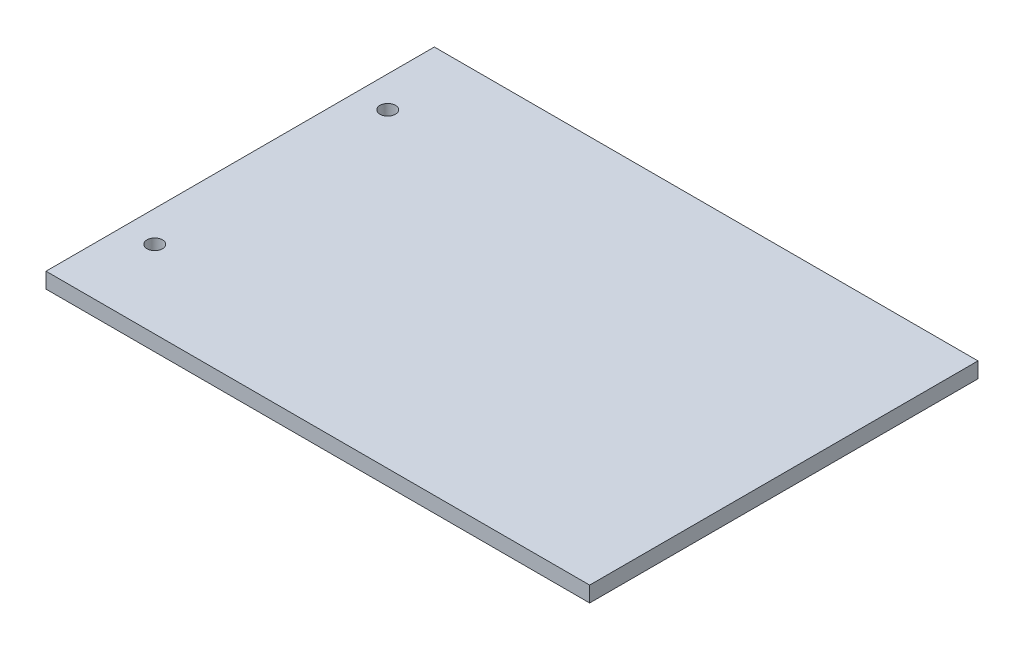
SolidWorks part; units mm, degrees
ref_plane "Front Plane" through (0, 0, 0) normal (0, 0, 1) x (1, 0, 0)
ref_plane "Top Plane" through (0, 0, 0) normal (0, 1, 0) x (1, 0, 0)
ref_plane "Right Plane" through (0, 0, 0) normal (1, 0, 0) x (0, 0, -1)
sketch "Sketch1" plane through (0, 0, 0) normal (0, 1, 0) x (1, 0, 0)
  line L0 (-25, 25) -> (-25, -25) construction
  line L1 (-35, 25) -> (35, 25)
  line L2 (-35, 25) -> (-35, -25)
  line L3 (-35, -25) -> (35, -25)
  line L4 (35, 25) -> (35, -25)
  line L5 (-35, 25) -> (35, -25) construction
  line L6 (-35, -25) -> (35, 25) construction
  line L7 (-31, 25) -> (-31, -25) construction
  circle A0 centre (-31, 15) radius 1
  circle A1 centre (-31, -15) radius 1
  point P0 (0, 0)
  dimension "D5" = 30
  dimension "D6" = 10
  dimension "D1" = 50
  dimension "D2" = 70
  dimension "D3" = 10
  dimension "D4" = 6
extrude "Boss-Extrude1" add sketch "Sketch1" along normal blind 2
